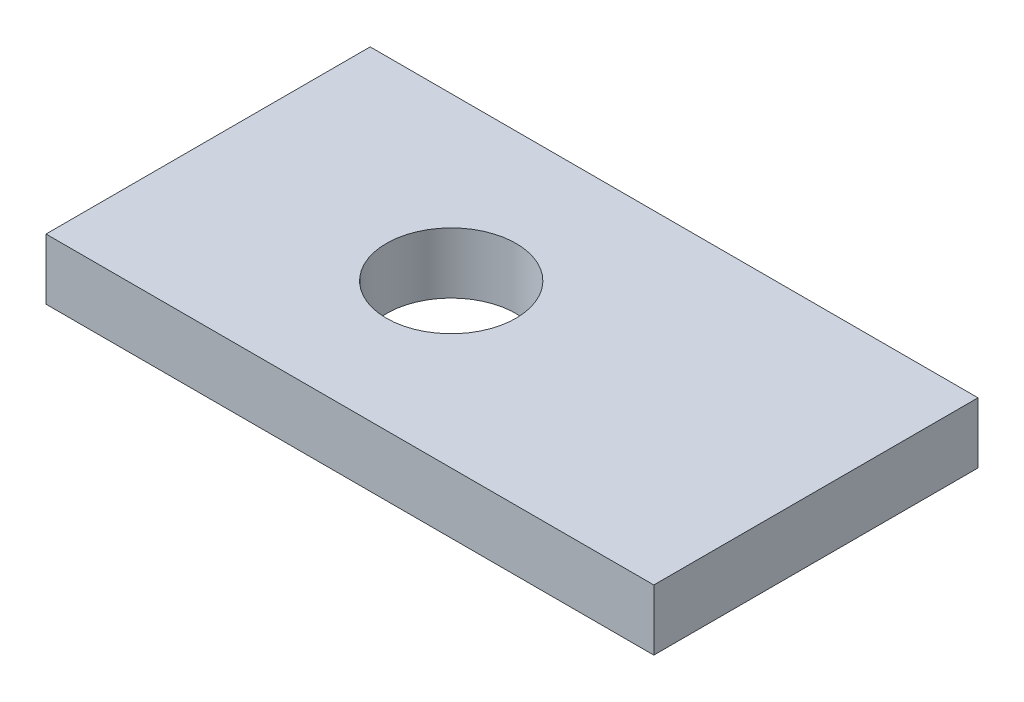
SolidWorks part; units mm, degrees
ref_plane "前视基准面" through (0, 0, 0) normal (0, 0, 1) x (1, 0, 0)
ref_plane "上视基准面" through (0, 0, 0) normal (0, 1, 0) x (1, 0, 0)
ref_plane "右视基准面" through (0, 0, 0) normal (1, 0, 0) x (0, 0, -1)
other "Configuration Table"
sketch "BaseSketch" plane through (0, 0, 0) normal (0, 1, 0) x (1, 0, 0)
  line L1 (0, 0) -> (150, 0)
  line L2 (0, 0) -> (0, 80)
  line L3 (0, 80) -> (150, 80)
  line L4 (150, 0) -> (150, 80)
  dimension "D1" = 150
  dimension "D2" = 80
extrude "BaseBoss" add sketch "BaseSketch" against normal blind 15
sketch "HoleSketch_1" plane through (0, 0, 0) normal (0, 1, 0) x (1, 0, 0)
  circle A0 centre (60, 40) radius 16
  dimension "D1" = 32
extrude "HoleCut_1" cut sketch "HoleSketch_1" against normal blind 15
